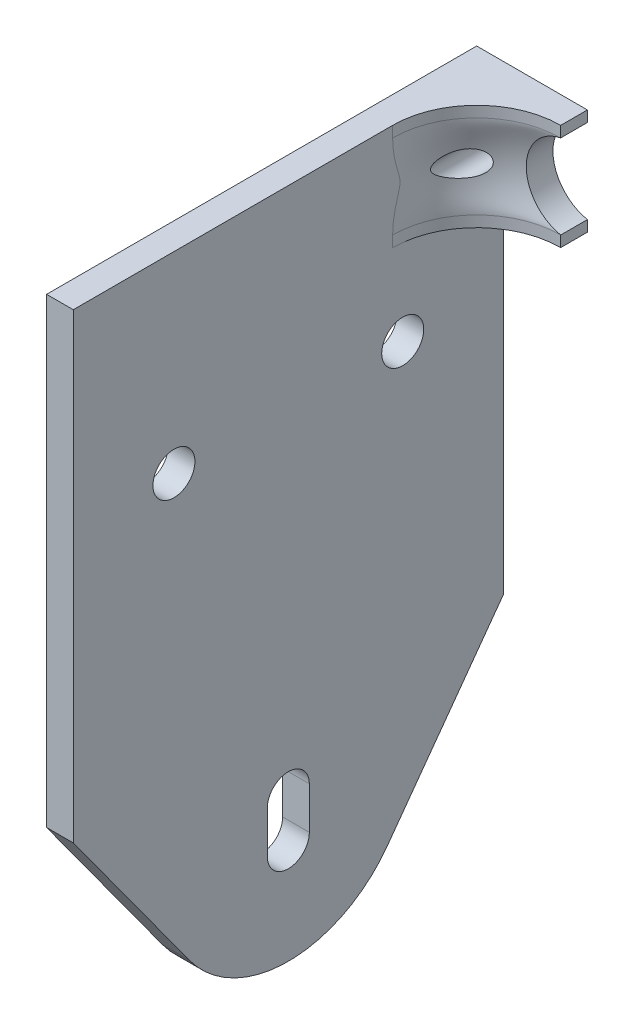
SolidWorks part; units mm, degrees
ref_plane "Front Plane" through (0, 0, 0) normal (0, 0, 1) x (1, 0, 0)
ref_plane "Top Plane" through (0, 0, 0) normal (0, 1, 0) x (1, 0, 0)
ref_plane "Right Plane" through (0, 0, 0) normal (1, 0, 0) x (0, 0, -1)
sketch "Sketch1" plane through (0, 0, 0) normal (0, 0, 1) x (1, 0, 0)
  line L11 (11, -63.3052) -> (11, -24.7175)
  line L12 (14.175, -31.7623) -> (14.175, -63.3052)
  line L13 (14.175, -63.3052) -> (11, -63.3052)
  line L14 (14.175, 6.3) -> (14.175, -31.7623)
  line L15 (11, -24.7175) -> (11, -6.3137)
  line L16 (11, -6.3137) -> (5.952, -6.3137)
  line L17 (5.952, -6.3137) -> (1, -6.3)
  line L18 (1, -6.3) -> (1, -5.001)
  line L19 (1, 5.001) -> (1, 6.3)
  line L20 (1, 6.3) -> (14.175, 6.3)
  line L21 (1, 5.001) -> (11, 5.001)
  line L22 (0, 0) -> (0, 14.9046) construction
  line L23 (-1, -6.3) -> (-1, -5.001)
  line L24 (-5.952, -6.3137) -> (-1, -6.3)
  line L25 (-11, -6.3137) -> (-5.952, -6.3137)
  line L26 (-11, -24.7175) -> (-11, -6.3137)
  line L27 (-11, -63.3052) -> (-11, -24.7175)
  line L28 (-14.175, -63.3052) -> (-11, -63.3052)
  line L29 (-14.175, -31.7623) -> (-14.175, -63.3052)
  line L30 (-14.175, 6.3) -> (-14.175, -31.7623)
  line L31 (-1, 6.3) -> (-14.175, 6.3)
  line L32 (-1, 5.001) -> (-1, 6.3)
  line L34 (-14.175, 6.3) -> (-11, 6.3)
  line L35 (-14.175, 6.3) -> (-14.175, -73.7)
  line L36 (-14.175, -73.7) -> (-11, -73.7)
  line L37 (-11, 6.3) -> (-11, -73.7)
  arc A1 (1, -5.001) -> (1, 5.001) centre (0, 0) ccw
  arc A2 (-1, -5.001) -> (-1, 5.001) centre (0, 0) cw
  circle A4 centre (-9, 0) radius 1.5
  dimension "D1" = 80
extrude "Boss-Extrude1" add sketch "Sketch1" along normal blind 3.175 contours L23 A2 L32 L31 L37 L25 L24 A4 | L37 L31 L30 L29 L28 L27 L26 | L37 L28 L35 L36
sketch "Sketch2" plane through (0, 0, 3.175) normal (0, 0, 1) x (1, 0, 0)
  line L1 (-14.175, 6.3) -> (-11, 6.3)
  line L2 (-14.175, 6.3) -> (-14.175, -73.7)
  line L3 (-14.175, -73.7) -> (-11, -73.7)
  line L4 (-11, 6.3) -> (-11, -73.7)
  line L8 (-1, -6.3) -> (-1, -5.001)
  line L9 (-1, 5.001) -> (-1, 6.3)
  line L10 (-1, 6.3) -> (-14.175, 6.3)
  line L11 (-14.175, 6.3) -> (-14.175, -73.7)
  line L12 (-14.175, -73.7) -> (-11, -73.7)
  line L13 (-11, -73.7) -> (-11, -6.3137)
  line L14 (-11, -6.3137) -> (-5.952, -6.3137)
  line L15 (-5.952, -6.3137) -> (-1, -6.3)
  line L16 (-1, -6.3) -> (-1, -5.001)
  line L17 (-1, 5.001) -> (-1, 6.3)
  line L18 (-1, 6.3) -> (-14.175, 6.3)
  line L19 (-14.175, 6.3) -> (-14.175, -73.7)
  line L20 (-14.175, -73.7) -> (-11, -73.7)
  line L21 (-11, -73.7) -> (-11, -6.3137)
  line L22 (-11, -6.3137) -> (-5.952, -6.3137)
  line L23 (-5.952, -6.3137) -> (-1, -6.3)
  arc A1 (-1, 5.001) -> (-1, -5.001) centre (0, 0) ccw
  arc A2 (-1, 5.001) -> (-1, -5.001) centre (0, 0) ccw
  dimension "D1" = 0
extrude "Boss-Extrude2" add sketch "Sketch2" along normal up to vertex contours L4 M18 M19 M20 M21
sketch "Sketch3" plane through (-14.175, 0, 0) normal (-1, 0, 0) x (0, 0, 1)
  line L0 (28.0875, -56.6) -> (28.0875, -61.6) construction
  line L1 (23.0875, -56.6) -> (23.0875, -61.6) construction
  line L2 (28.0875, -56.6) -> (28.0875, -61.6)
  line L3 (23.0875, -56.6) -> (23.0875, -61.6)
  line L4 (25.5875, -61.6) -> (25.5875, -56.6) construction
  line L6 (39.4599, -63.4739) -> (51.175, -26.3178)
  line L8 (11.6062, -63.1124) -> (0, -22.6705)
  line L9 (25.5875, -73.6456) -> (25.5875, 6.3) construction
  line L10 (0, 6.3) -> (0, -73.7) construction
  line L11 (51.175, -73.7) -> (0, -73.7) construction
  line L15 (0, 6.3) -> (0, -73.7)
  line L16 (0, -73.7) -> (51.175, -73.7)
  line L17 (51.175, -73.7) -> (51.175, 6.3)
  line L18 (51.175, 6.3) -> (0, 6.3)
  line L19 (0, 6.3) -> (0, -73.7)
  line L20 (0, -73.7) -> (51.175, -73.7)
  line L21 (51.175, -73.7) -> (51.175, 6.3)
  line L22 (51.175, 6.3) -> (0, 6.3)
  circle A0 centre (39.1996, -16.5646) radius 2.5 construction
  circle A1 centre (11.9754, -16.5646) radius 2.5 construction
  arc A2 (23.0875, -61.6) -> (28.0875, -61.6) centre (25.5875, -61.6) ccw construction
  arc A3 (28.0875, -56.6) -> (23.0875, -56.6) centre (25.5875, -56.6) ccw construction
  circle A4 centre (39.1996, -16.5646) radius 2.5
  circle A5 centre (11.9754, -16.5646) radius 2.5
  arc A6 (23.0875, -61.6) -> (28.0875, -61.6) centre (25.5875, -61.6) ccw
  arc A7 (28.0875, -56.6) -> (23.0875, -56.6) centre (25.5875, -56.6) ccw
  arc A9 (11.6062, -63.1124) -> (39.4599, -63.4739) centre (25.5875, -59.1) ccw
  dimension "D2" = 11.6062
  dimension "D3" = 39.4599
  dimension "D1" = 14.5456
  dimension "D5" = 0
extrude "Cut-Extrude1" cut sketch "Sketch3" against normal through all contours A5 | A4 | L2 A7 L3 A6 | A9 L8 L6 M12 M13 M14
fillet "Fillet1" radius 10 1 edges at (-11, -0.0069, 3.175)
fillet "Fillet2" radius 15 1 edges at (-12.5875, 6.3, 51.175)
fillet "Fillet3" radius 50 2 edges at (-12.5875, -22.6705, 0) (-12.5875, -26.3178, 51.175)
sketch "Sketch4" plane through (-14.175, 0, 0) normal (-1, 0, 0) x (0, 0, 1)
  line L0 (0, -48.6456) -> (14.9846, -69.2514)
  line L1 (0, 6.3) -> (51.175, 6.3)
  line L2 (0, 6.3) -> (0, -48.6456)
  line L3 (25.5875, -73.6456) -> (51.175, -73.6456) construction
  line L4 (51.175, 6.3) -> (51.175, -48.6456)
  line L5 (0, 6.3) -> (0, -15.6379)
  line L6 (1.94, -29.4304) -> (11.6062, -63.1124)
  line L7 (39.4599, -63.4739) -> (48.8609, -33.6572)
  line L8 (51.175, -18.6222) -> (51.175, -8.7)
  line L9 (36.175, 6.3) -> (0, 6.3)
  line L10 (0, 6.3) -> (0, -15.6379) construction
  line L11 (1.94, -29.4304) -> (11.6062, -63.1124)
  line L12 (39.4599, -63.4739) -> (48.8609, -33.6572)
  line L13 (51.175, -18.6222) -> (51.175, -8.7) construction
  line L14 (36.175, 6.3) -> (0, 6.3) construction
  line L15 (25.5875, -59.1) -> (25.5875, -24.0492) construction
  line L16 (-13.9483, -29.4649) -> (0, -48.6456) construction
  line L17 (51.175, -48.6456) -> (36.1904, -69.2514)
  line L18 (0, -48.6456) -> (0, -73.6456) construction
  line L19 (0, -73.6456) -> (25.5875, -73.6456) construction
  line L20 (51.175, -48.6456) -> (51.175, -73.6456) construction
  arc A4 (0, -15.6379) -> (1.94, -29.4304) centre (50, -15.6379) ccw
  arc A5 (11.6062, -63.1124) -> (39.4599, -63.4739) centre (25.5875, -59.1) ccw
  arc A6 (48.8609, -33.6572) -> (51.175, -18.6222) centre (1.175, -18.6222) ccw
  arc A7 (51.175, -8.7) -> (36.175, 6.3) centre (36.175, -8.7) ccw
  arc A8 (0, -15.6379) -> (1.94, -29.4304) centre (50, -15.6379) ccw construction
  arc A9 (11.6062, -63.1124) -> (39.4599, -63.4739) centre (25.5875, -59.1) ccw construction
  arc A10 (48.8609, -33.6572) -> (51.175, -18.6222) centre (1.175, -18.6222) ccw construction
  arc A11 (51.175, -8.7) -> (36.175, 6.3) centre (36.175, -8.7) ccw construction
  dimension "D2" = 25
  dimension "D1" = 0
extrude "Boss-Extrude3" add sketch "Sketch4" against normal blind 3.175 contours L2 L0 M18 M20 M19 | L17 L4 M22 M21 M20 | L4 L1 M24
